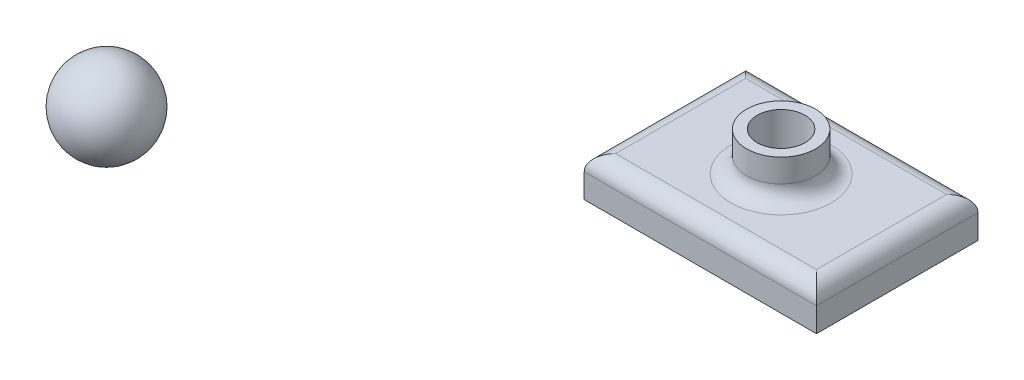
SolidWorks part; units mm, degrees
ref_plane "Front Plane" through (0, 0, 0) normal (0, 0, 1) x (1, 0, 0)
ref_plane "Top Plane" through (0, 0, 0) normal (0, 1, 0) x (1, 0, 0)
ref_plane "Right Plane" through (0, 0, 0) normal (1, 0, 0) x (0, 0, -1)
sketch "Sketch1"
revolve "Revolve1" add sketch "Sketch1" angle 360 about L0
sketch "Sketch3"
extrude "Extrude2" add sketch "Sketch3" along normal blind 32.258
sketch "Sketch4"
extrude "Extrude3" add sketch "Sketch4" along normal blind 31.496
fillet "Fillet1" radius 12.7 5 edges at (317.3354, 32.258, -255.8098) (317.3354, 32.258, -293.2334) (411.2043, 32.258, -227.9481) (317.3354, 32.258, -162.6628) (223.4664, 32.258, -227.9481)
sketch "Sketch5"
extrude "Extrude4" cut sketch "Sketch5" against normal blind 31.496
